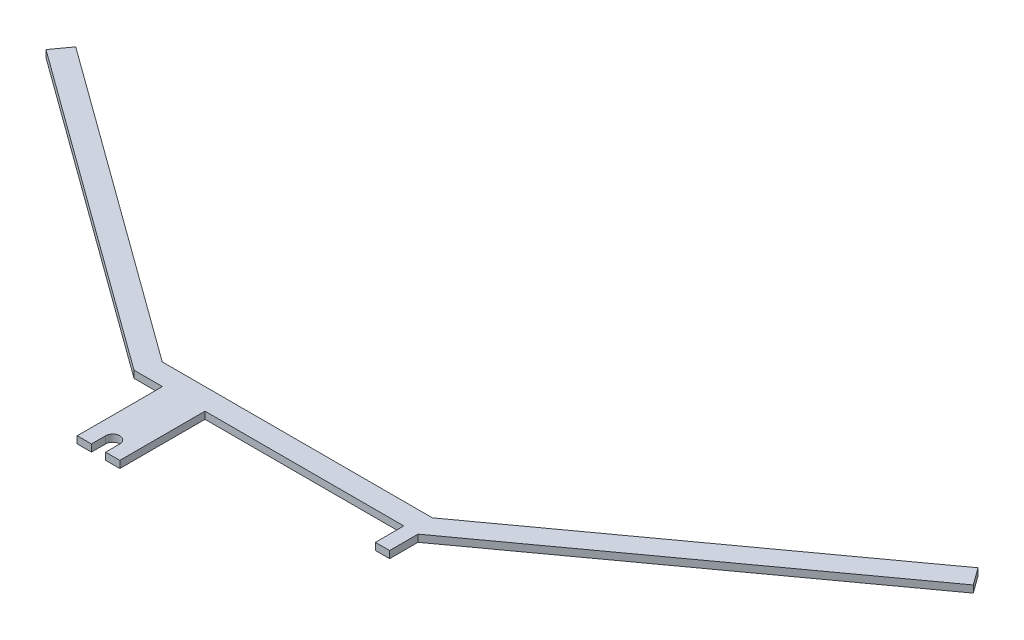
SolidWorks part; units mm, degrees
ref_plane "前视基准面" through (0, 0, 0) normal (0, 0, 1) x (1, 0, 0)
ref_plane "上视基准面" through (0, 0, 0) normal (0, 1, 0) x (1, 0, 0)
ref_plane "右视基准面" through (0, 0, 0) normal (1, 0, 0) x (0, 0, -1)
sketch "草图1" plane through (0, 0, 0) normal (0, 1, 0) x (1, 0, 0)
  line L0 (0, 0) -> (0, -51.4782) construction
  line L1 (-31.7734, -28.8317) -> (-9.5127, -45)
  line L2 (-9.5127, -45) -> (9.5127, -45)
  line L3 (-31.7734, -28.8317) -> (-32.6549, -30.0454)
  line L4 (-32.6549, -30.0454) -> (-10, -46.5)
  line L5 (-10, -46.5) -> (10, -46.5)
  line L6 (31.7734, -28.8317) -> (32.6549, -30.0454)
  line L7 (31.7734, -28.8317) -> (9.5127, -45)
  line L8 (32.6549, -30.0454) -> (10, -46.5)
  circle A0 centre (0, 0) radius 42 construction
  point P8 (0, -42)
  point P14 (0, -46.5)
  point P15 (0, -45)
  dimension "D1" = 84
  dimension "D2" = 20
  dimension "D3" = 3
  dimension "D4" = 1.5
  dimension "D5" = 1.5
  dimension "D6" = 28
extrude "凸台-拉伸1" add sketch "草图1" along normal mid plane 0.5
sketch "草图2" plane through (0, 0.25, 0) normal (0, 1, 0) x (1, 0, 0)
  line L0 (0, -45) -> (0, -49.7255) construction
  line L1 (9.5127, -45) -> (-9.5127, -45) construction
  line L2 (-10, -46.5) -> (10, -46.5) construction
  line L3 (-10, -46.5) -> (-9, -46.5)
  line L4 (-10, -46.5) -> (-10, -48.5)
  line L5 (-10, -48.5) -> (-9, -48.5)
  line L6 (-9, -46.5) -> (-9, -48.5)
  line L7 (10, -48.5) -> (9, -48.5)
  line L8 (9, -46.5) -> (9, -48.5)
  line L9 (10, -46.5) -> (9, -46.5)
  line L10 (10, -46.5) -> (10, -48.5)
  point P11 (-9.5, -48.5)
  dimension "D1" = 1
  dimension "D2" = 2
extrude "凸台-拉伸2" add sketch "草图2" against normal up to surface (0.5 mm away)
sketch "草图5" plane through (0, -0.25, 0) normal (0, -1, 0) x (1, 0, 0)
  line L1 (9, 46.5) -> (13.5371, 46.5)
  line L2 (9, 46.5) -> (9, 50.8222)
  line L3 (9, 50.8222) -> (13.5371, 50.8222)
  line L4 (13.5371, 46.5) -> (13.5371, 50.8222)
extrude "切除-拉伸1" cut sketch "草图5" against normal through all
sketch "草图6" plane through (0, -0.25, 0) normal (0, -1, 0) x (1, 0, 0)
  line L0 (-9, 46.5) -> (10, 46.5) construction
  line L1 (-5, 46.5) -> (-8, 46.5)
  line L2 (-5, 46.5) -> (-5, 52.5)
  line L3 (-5, 52.5) -> (-8, 52.5)
  line L4 (-8, 46.5) -> (-8, 52.5)
  line L5 (10, 46.5) -> (10, 49.9674) construction
  dimension "D1" = 6
  dimension "D2" = 3
  dimension "D3" = 15
extrude "凸台-拉伸3" add sketch "草图6" against normal up to surface (0.5 mm away)
sketch "草图7" plane through (0, -0.25, 0) normal (0, -1, 0) x (1, 0, 0)
  line L0 (-6.5, 52.5) -> (-6.5, 51.5) construction
  line L1 (-5, 52.5) -> (-8, 52.5) construction
  line L2 (-7, 51.5) -> (-7, 55.2784)
  line L3 (-7, 55.2784) -> (-6, 55.2784)
  line L4 (-6, 55.2784) -> (-6, 51.5)
  arc A0 (-7, 51.5) -> (-6, 51.5) centre (-6.5, 51.5) ccw
  dimension "D1" = 1
  dimension "D2" = 1
extrude "切除-拉伸2" cut sketch "草图7" against normal through all
sketch "草图8" plane through (0, -0.25, 0) normal (0, -1, 0) x (1, 0, 0)
  line L0 (10, 46.5) -> (10, 48.5)
  line L1 (10, 48.5) -> (9, 48.5)
  line L2 (9, 48.5) -> (9, 46.5)
  line L3 (-5, 46.5) -> (10, 46.5) construction
  line L4 (9, 46.5) -> (10, 46.5)
  dimension "D1" = 1
  dimension "D2" = 2
extrude "凸台-拉伸4" add sketch "草图8" against normal up to surface (0.5 mm away)
sketch "草图9" plane through (0, -0.25, 0) normal (0, -1, 0) x (1, 0, 0)
  line L1 (-9, 46.5) -> (-12.605, 46.5)
  line L2 (-9, 46.5) -> (-9, 49.7143)
  line L3 (-9, 49.7143) -> (-12.605, 49.7143)
  line L4 (-12.605, 46.5) -> (-12.605, 49.7143)
extrude "切除-拉伸3" cut sketch "草图9" against normal through all
